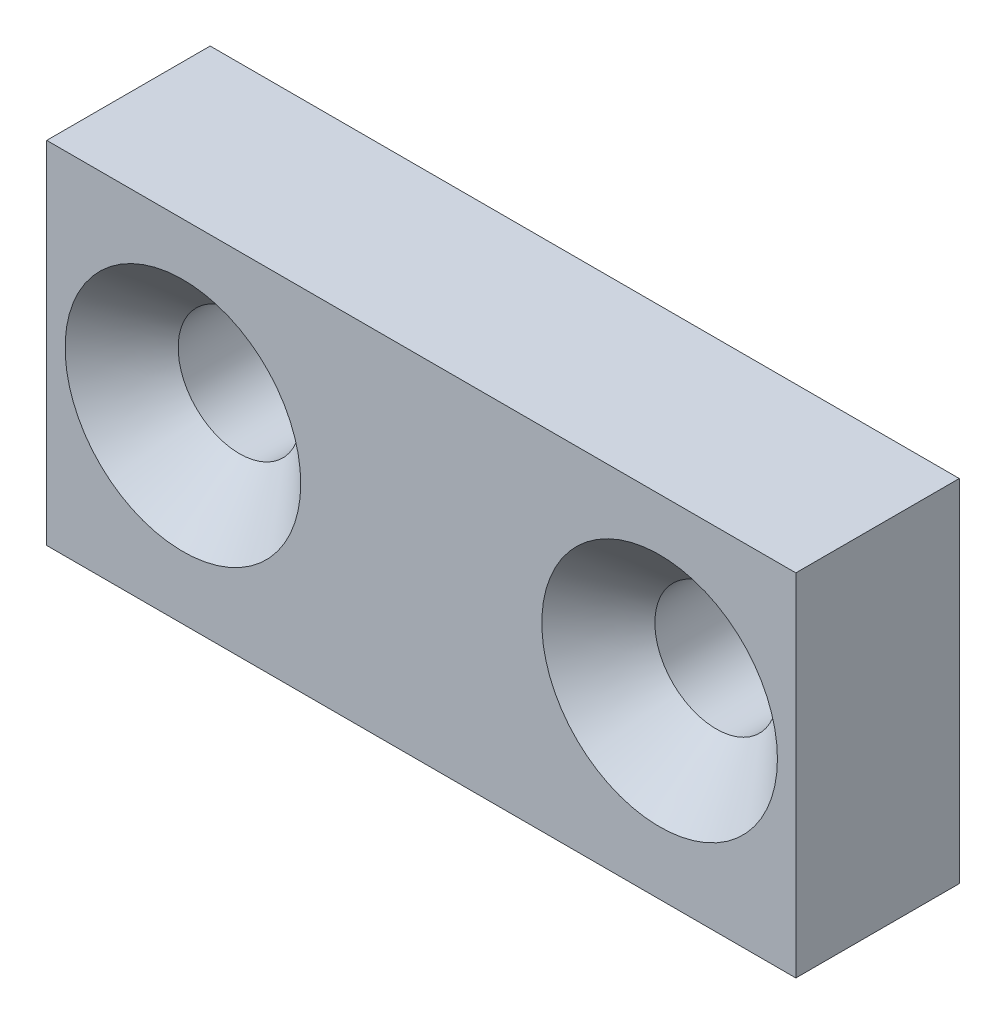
SolidWorks part; units mm, degrees
ref_plane "Plan de face" through (0, 0, 0) normal (0, 0, 1) x (1, 0, 0)
ref_plane "Plan de dessus" through (0, 0, 0) normal (0, 1, 0) x (1, 0, 0)
ref_plane "Plan de droite" through (0, 0, 0) normal (1, 0, 0) x (0, 0, -1)
sketch "Esquisse1" plane through (0, 0, 0) normal (0, 0, 1) x (1, 0, 0)
  line L1 (0, 0) -> (-605, 0) construction
  line L2 (-543, 0) -> (-598, 0)
  line L3 (-543, 0) -> (-543, 25.76)
  line L4 (-543, 25.76) -> (-598, 25.76)
  line L5 (-598, 0) -> (-598, 25.76)
  line L6 (-33.46, 25.76) -> (-583.6, 25.76) construction
  circle A0 centre (-553, 13.26) radius 4.5 construction
  circle A1 centre (-588, 13.26) radius 4.5 construction
  dimension "D1" = 10
  dimension "D2" = 10
extrude "Extrusion1" add sketch "Esquisse1" along normal up to surface (12 mm away)
hole_wizard "Fraisage pour vis à tête fraisée M81" positions "Esquisse3" profile "Esquisse2" countersink size "M8" standard "ISO"
sketch "Esquisse3" plane through (0, 0, 12) normal (0, 0, 1) x (1, 0, 0)
  point P0 (-553, 13.26)
  point P5 (-588, 13.26)
sketch "Esquisse2" plane through (-553, 13.26, 12) normal (1, 0, 0) x (0, -1, 0)
  line L0 (0, 0) -> (0, 12)
  line L1 (0, 12) -> (4.5, 12)
  line L2 (4.5, 12) -> (4.5, 4.15)
  line L3 (4.5, 4.15) -> (8.65, 0)
  line L5 (8.65, 0) -> (0, 0)
  line L6 (-4.5, 4.15) -> (-8.65, 0) construction
  line L11 (0, -6.35) -> (0, 107.95) construction
  dimension "Diamètre du perçage jusqu'au prochain" = 9
  dimension "Profondeur du perçage jusqu'au prochain" = 12
  dimension "Diamètre du fraisage entrant" = 17.3
  dimension "Angle du fraisage entrant" = 90
